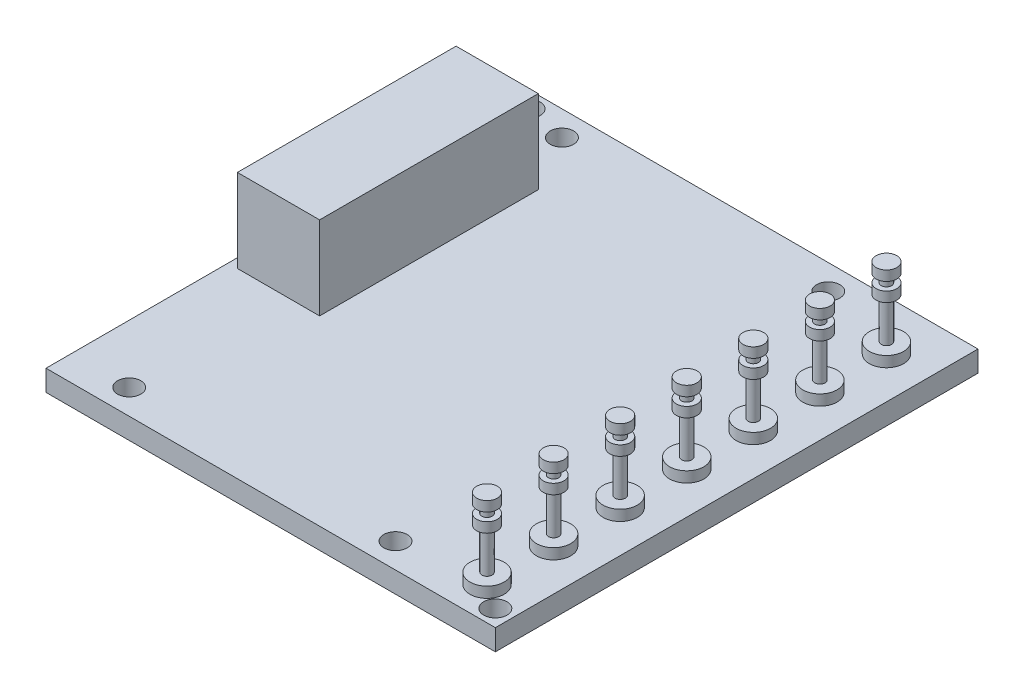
SolidWorks part; units mm, degrees
ref_plane "Front Plane" through (0, 0, 0) normal (0, 0, 1) x (1, 0, 0)
ref_plane "Top Plane" through (0, 0, 0) normal (0, 1, 0) x (1, 0, 0)
ref_plane "Right Plane" through (0, 0, 0) normal (1, 0, 0) x (0, 0, -1)
sketch "Sketch1" plane through (0, 0, 0) normal (0, 1, 0) x (1, 0, 0)
  line L1 (-17.145, -18.415) -> (17.145, -18.415)
  line L2 (-17.145, -18.415) -> (-17.145, 18.415)
  line L3 (-17.145, 18.415) -> (17.145, 18.415)
  line L4 (17.145, -18.415) -> (17.145, 18.415)
  line L5 (-17.145, -18.415) -> (17.145, 18.415) construction
  line L6 (-17.145, 18.415) -> (17.145, -18.415) construction
  point P0 (0, 0)
  dimension "D1" = 34.29
  dimension "D2" = 36.83
extrude "Boss-Extrude1" add sketch "Sketch1" along normal blind 1.6002
sketch "Sketch2" plane through (0, 1.6002, 0) normal (0, 1, 0) x (1, 0, 0)
  line L0 (17.145, 18.415) -> (-17.145, 18.415) construction
  line L1 (-16.4338, 12.1666) -> (-10.16, 12.1666)
  line L2 (-16.4338, 12.1666) -> (-16.4338, -4.5212)
  line L3 (-16.4338, -4.5212) -> (-10.16, -4.5212)
  line L4 (-10.16, 12.1666) -> (-10.16, -4.5212)
  line L5 (-17.145, 18.415) -> (-17.145, -18.415) construction
  dimension "D1" = 16.6878
  dimension "D2" = 6.2738
  dimension "D3" = 6.2484
  dimension "D4" = 0.7112
extrude "Boss-Extrude2" add sketch "Sketch2" along normal blind 6.35
sketch "Sketch3" plane through (0, 0, 0) normal (0, -1, 0) x (1, 0, 0)
  circle A0 centre (-10.6274, -5.9905) radius 0.3277
  dimension "D1" = 0.6553
extrude "Boss-Extrude3" add sketch "Sketch3" along normal blind 1.4732
hole_wizard "#50 (0.07) Diameter Hole1" positions "Sketch4" profile "Sketch5" hole size "#50" standard "ANSI Inch"
sketch "Sketch4" plane through (0, 1.6002, 0) normal (0, 1, 0) x (1, 0, 0)
  line L2 (-17.145, 18.415) -> (-17.145, -18.415) construction
  line L5 (17.145, 18.415) -> (-17.145, 18.415) construction
  point P0 (-15.875, 17.145)
  point P2 (15.875, -17.145)
  dimension "D1" = 1.27
  dimension "D2" = 31.75
  dimension "D3" = 1.27
  dimension "D4" = 34.29
sketch "Sketch5" plane through (-15.875, 1.6002, -17.145) normal (1, 0, 0) x (0, 0, 1)
  line L0 (0, 0) -> (0, 3.0734)
  line L1 (0, 3.0734) -> (0.889, 3.0734)
  line L2 (0.889, 3.0734) -> (0.889, 0)
  line L5 (0.889, 0) -> (0, 0)
  line L11 (0, -6.35) -> (0, 107.95) construction
  dimension "Thru Hole Dia." = 1.778
  dimension "Thru Hole Depth" = 3.0734
ref_plane "Plane1" through (13.97, 0, 0) normal (1, 0, 0) x (0, 0, -1)
sketch "Sketch6" plane through (13.97, 0, 0) normal (1, 0, 0) x (0, 0, -1)
  line L0 (-15.875, 1.6002) -> (-15.875, 11.3077) construction
  line L1 (-15.875, 1.6002) -> (-17.1831, 1.6002)
  line L2 (-17.1831, 1.6002) -> (-17.1831, 2.413)
  line L3 (-17.1831, 2.413) -> (-16.2687, 2.413)
  line L4 (-16.2687, 2.413) -> (-16.2687, 5.5372)
  line L5 (-16.2687, 5.5372) -> (-16.6624, 5.5372)
  line L6 (-16.6624, 5.5372) -> (-16.6624, 6.2992)
  line L7 (-16.6624, 6.2992) -> (-16.2687, 6.2992)
  line L8 (-16.2687, 6.2992) -> (-16.2687, 6.9342)
  line L9 (-16.2687, 6.9342) -> (-16.6624, 6.9342)
  line L10 (-16.6624, 6.9342) -> (-16.6624, 7.6962)
  line L11 (-16.6624, 7.6962) -> (-15.875, 7.6962)
  line L12 (-15.875, 7.6962) -> (-15.875, 1.6002)
  line L13 (-18.415, 1.6002) -> (18.415, 1.6002) construction
  line L14 (-18.415, 1.6002) -> (-18.415, 0) construction
  dimension "D1" = 6.096
  dimension "D2" = 0.762
  dimension "D3" = 0.635
  dimension "D4" = 0.8128
  dimension "D5" = 0.7874
  dimension "D6" = 2.6162
  dimension "D7" = 1.5748
  dimension "D8" = 2.54
revolve "Revolve1" add sketch "Sketch6" angle 360 about L0
pattern_linear "LPattern1" count 7 spacing 5.08 along (0, 0, -1) of "Revolve1"
sketch "Sketch7" plane through (0, 1.6002, 0) normal (0, 1, 0) x (1, 0, 0)
  line L0 (-15.875, 17.145) -> (15.875, -17.145) construction
  line L1 (17.145, -18.415) -> (17.145, 18.415) construction
  line L2 (-17.145, -18.415) -> (17.145, -18.415) construction
  dimension "D1" = 42.797
  dimension "D2" = 47.203
hole_wizard "#50 (0.07) Diameter Hole2" positions "Sketch9" profile "Sketch10" hole size "#50" standard "ANSI Inch"
sketch "Sketch9" plane through (0, 1.6002, 0) normal (0, 1, 0) x (1, 0, 0)
  line L1 (7.62, -16.51) -> (-12.7, -16.51) construction
  line L2 (7.62, -16.51) -> (7.62, 16.51) construction
  line L3 (7.62, 16.51) -> (-12.7, 16.51) construction
  line L4 (-12.7, -16.51) -> (-12.7, 16.51) construction
  line L7 (0, 0) -> (7.62, 0) construction
  point P0 (-12.7, 16.51)
  point P2 (7.62, 16.51)
  point P4 (-12.7, -16.51)
  point P6 (7.62, -16.51)
  dimension "D1" = 33.02
  dimension "D2" = 12.7
  dimension "D3" = 7.62
sketch "Sketch10" plane through (-12.7, 1.6002, -16.51) normal (1, 0, 0) x (0, 0, 1)
  line L0 (0, 0) -> (0, 3.0734)
  line L1 (0, 3.0734) -> (0.889, 3.0734)
  line L2 (0.889, 3.0734) -> (0.889, 0)
  line L5 (0.889, 0) -> (0, 0)
  line L11 (0, -6.35) -> (0, 107.95) construction
  dimension "Thru Hole Dia." = 1.778
  dimension "Thru Hole Depth" = 3.0734
